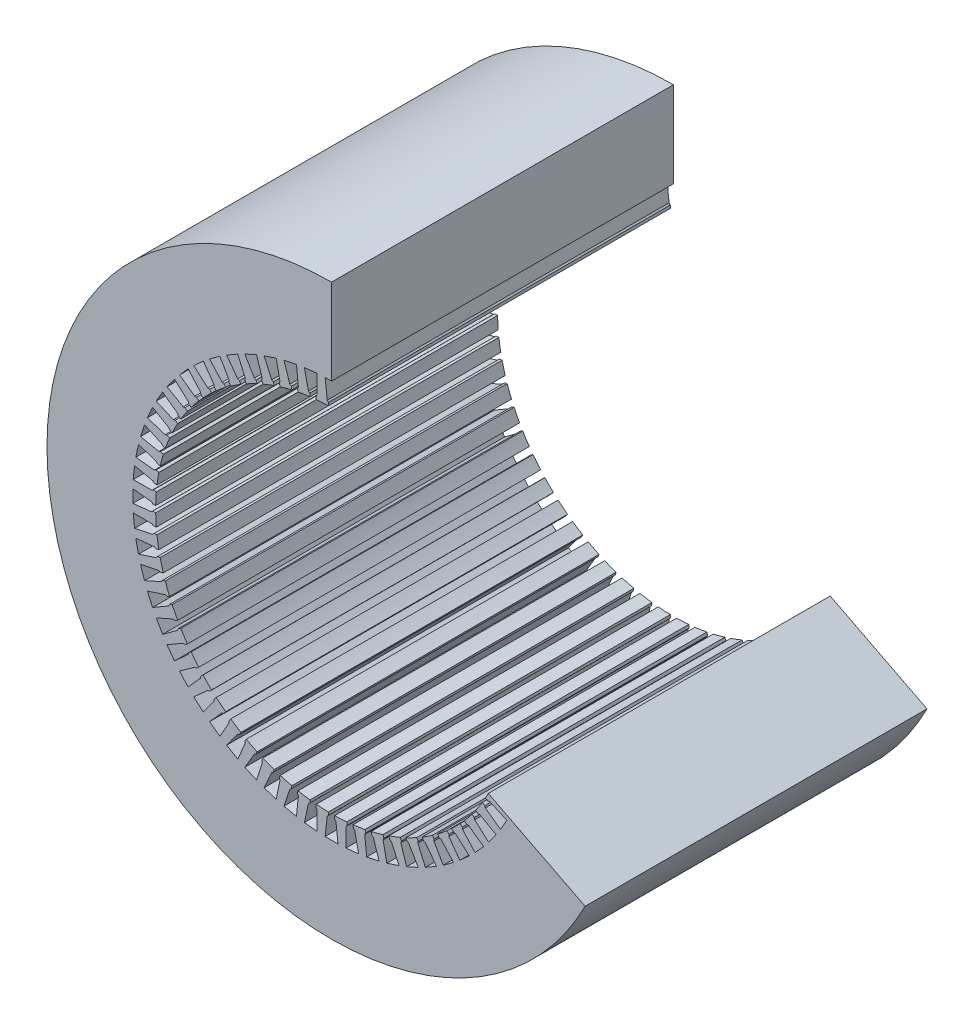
SolidWorks part; units mm, degrees
ref_plane "Přední rovina" through (0, 0, 0) normal (0, 0, 1) x (1, 0, 0)
ref_plane "Horní rovina" through (0, 0, 0) normal (0, 1, 0) x (1, 0, 0)
ref_plane "Pravá rovina" through (0, 0, 0) normal (1, 0, 0) x (0, 0, -1)
sketch "Skica1" plane through (0, 0, 0) normal (0, 0, 1) x (1, 0, 0)
  line L0 (0, 148.7514) -> (0, -162.0328) construction
  line L1 (-203.1858, 0) -> (251.9227, 0) construction
  line L2 (1.4, 79.8) -> (1.4, 78.4875)
  line L3 (0, 78.5) -> (0, 88.71)
  line L4 (-2.855, 88.71) -> (2.855, 88.71)
  line L5 (0, 88.71) -> (0, 80.4)
  line L7 (0, 80.4) -> (0, 79.8)
  line L9 (1.4, 79.8) -> (1.945, 80.4)
  line L10 (2.855, 88.71) -> (1.945, 80.4)
  line L11 (-1.4, 79.8) -> (-1.945, 80.4)
  line L12 (-2.855, 88.71) -> (-1.945, 80.4)
  line L13 (6.4334, 88.5225) -> (6.4697, 80.1629)
  line L14 (6.4334, 88.5225) -> (12.1121, 87.9256)
  line L15 (12.1121, 87.9256) -> (10.3384, 79.7563)
  line L16 (6.949, 79.5092) -> (6.4697, 80.1629)
  line L18 (9.7337, 79.2165) -> (10.3384, 79.7563)
  line L19 (15.6512, 87.3651) -> (14.8136, 79.0475)
  line L20 (15.6512, 87.3651) -> (21.2365, 86.1779)
  line L21 (21.2365, 86.1779) -> (18.6186, 78.2387)
  line L22 (15.2219, 78.3473) -> (14.8136, 79.0475)
  line L24 (17.9608, 77.7651) -> (18.6186, 78.2387)
  line L25 (24.6976, 85.2505) -> (22.9952, 77.066)
  line L26 (24.6976, 85.2505) -> (30.1282, 83.486)
  line L27 (30.1282, 83.486) -> (26.6948, 75.8639)
  line L28 (23.3281, 76.3269) -> (22.9952, 77.066)
  line L30 (25.991, 75.4617) -> (26.6948, 75.8639)
  line L31 (33.4734, 82.2019) -> (30.9248, 74.2402)
  line L32 (33.4734, 82.2019) -> (38.6898, 79.8794)
  line L33 (38.6898, 79.8794) -> (34.4785, 72.658)
  line L34 (31.1786, 73.4704) -> (30.9248, 74.2402)
  line L36 (33.7365, 72.3315) -> (34.4785, 72.658)
  line L37 (41.8825, 78.2526) -> (38.5156, 70.6009)
  line L38 (41.8825, 78.2526) -> (46.8275, 75.3976)
  line L39 (46.8275, 75.3976) -> (41.8844, 68.6559)
  line L40 (38.6876, 69.8088) -> (38.5156, 70.6009)
  line L42 (41.1124, 68.4088) -> (41.8844, 68.6559)
  line L43 (49.8327, 73.446) -> (45.6844, 66.1882)
  line L44 (49.8327, 73.446) -> (54.4522, 70.0898)
  line L45 (54.4522, 70.0898) -> (48.8315, 63.9017)
  line L46 (45.7726, 65.3825) -> (45.6844, 66.1882)
  line L48 (48.0379, 63.7367) -> (48.8315, 63.9017)
  line L49 (57.2369, 67.8347) -> (52.3527, 61.0503)
  line L50 (57.2369, 67.8347) -> (61.4803, 64.014)
  line L51 (61.4803, 64.014) -> (55.2435, 58.4474)
  line L52 (52.3562, 60.2397) -> (52.3527, 61.0503)
  line L54 (54.437, 58.3662) -> (55.2435, 58.4474)
  line L55 (64.014, 61.4803) -> (58.4474, 55.2435)
  line L56 (64.014, 61.4803) -> (67.8347, 57.2369)
  line L57 (67.8347, 57.2369) -> (61.0503, 52.3527)
  line L58 (58.3662, 54.437) -> (58.4474, 55.2435)
  line L60 (60.2397, 52.3562) -> (61.0503, 52.3527)
  line L61 (70.0898, 54.4522) -> (63.9017, 48.8315)
  line L62 (70.0898, 54.4522) -> (73.446, 49.8327)
  line L63 (73.446, 49.8327) -> (66.1882, 45.6844)
  line L64 (63.7367, 48.0379) -> (63.9017, 48.8315)
  line L66 (65.3825, 45.7726) -> (66.1882, 45.6844)
  line L67 (75.3976, 46.8275) -> (68.6559, 41.8844)
  line L68 (75.3976, 46.8275) -> (78.2526, 41.8825)
  line L69 (78.2526, 41.8825) -> (70.6009, 38.5156)
  line L70 (68.4088, 41.1124) -> (68.6559, 41.8844)
  line L72 (69.8088, 38.6876) -> (70.6009, 38.5156)
  line L73 (79.8794, 38.6898) -> (72.658, 34.4785)
  line L74 (79.8794, 38.6898) -> (82.2019, 33.4734)
  line L75 (82.2019, 33.4734) -> (74.2402, 30.9248)
  line L76 (72.3315, 33.7365) -> (72.658, 34.4785)
  line L78 (73.4704, 31.1786) -> (74.2402, 30.9248)
  line L79 (83.486, 30.1282) -> (75.8639, 26.6948)
  line L80 (83.486, 30.1282) -> (85.2505, 24.6976)
  line L81 (85.2505, 24.6976) -> (77.066, 22.9952)
  line L82 (75.4617, 25.991) -> (75.8639, 26.6948)
  line L84 (76.3269, 23.3281) -> (77.066, 22.9952)
  line L85 (86.1779, 21.2365) -> (78.2387, 18.6186)
  line L86 (86.1779, 21.2365) -> (87.3651, 15.6512)
  line L87 (87.3651, 15.6512) -> (79.0475, 14.8136)
  line L88 (77.7651, 17.9608) -> (78.2387, 18.6186)
  line L90 (78.3473, 15.2219) -> (79.0475, 14.8136)
  line L91 (87.9256, 12.1121) -> (79.7563, 10.3384)
  line L92 (87.9256, 12.1121) -> (88.5225, 6.4334)
  line L93 (88.5225, 6.4334) -> (80.1629, 6.4697)
  line L94 (79.2165, 9.7337) -> (79.7563, 10.3384)
  line L96 (79.5092, 6.949) -> (80.1629, 6.4697)
  line L97 (88.71, 2.855) -> (80.4, 1.945)
  line L98 (88.71, 2.855) -> (88.71, -2.855)
  line L99 (88.71, -2.855) -> (80.4, -1.945)
  line L100 (79.8, 1.4) -> (80.4, 1.945)
  line L102 (79.8, -1.4) -> (80.4, -1.945)
  line L103 (88.5225, -6.4334) -> (80.1629, -6.4697)
  line L104 (88.5225, -6.4334) -> (87.9256, -12.1121)
  line L105 (87.9256, -12.1121) -> (79.7563, -10.3384)
  line L106 (79.5092, -6.949) -> (80.1629, -6.4697)
  line L108 (79.2165, -9.7337) -> (79.7563, -10.3384)
  line L109 (87.3651, -15.6512) -> (79.0475, -14.8136)
  line L110 (87.3651, -15.6512) -> (86.1779, -21.2365)
  line L111 (86.1779, -21.2365) -> (78.2387, -18.6186)
  line L112 (78.3473, -15.2219) -> (79.0475, -14.8136)
  line L114 (77.7651, -17.9608) -> (78.2387, -18.6186)
  line L115 (85.2505, -24.6976) -> (77.066, -22.9952)
  line L116 (85.2505, -24.6976) -> (83.486, -30.1282)
  line L117 (83.486, -30.1282) -> (75.8639, -26.6948)
  line L118 (76.3269, -23.3281) -> (77.066, -22.9952)
  line L120 (75.4617, -25.991) -> (75.8639, -26.6948)
  line L121 (82.2019, -33.4734) -> (74.2402, -30.9248)
  line L122 (82.2019, -33.4734) -> (79.8794, -38.6898)
  line L123 (79.8794, -38.6898) -> (72.658, -34.4785)
  line L124 (73.4704, -31.1786) -> (74.2402, -30.9248)
  line L126 (72.3315, -33.7365) -> (72.658, -34.4785)
  line L127 (78.2526, -41.8825) -> (70.6009, -38.5156)
  line L128 (78.2526, -41.8825) -> (75.3976, -46.8275)
  line L129 (75.3976, -46.8275) -> (68.6559, -41.8844)
  line L130 (69.8088, -38.6876) -> (70.6009, -38.5156)
  line L132 (68.4088, -41.1124) -> (68.6559, -41.8844)
  line L133 (73.446, -49.8327) -> (66.1882, -45.6844)
  line L134 (73.446, -49.8327) -> (70.0898, -54.4522)
  line L135 (70.0898, -54.4522) -> (63.9017, -48.8315)
  line L136 (65.3825, -45.7726) -> (66.1882, -45.6844)
  line L138 (63.7367, -48.0379) -> (63.9017, -48.8315)
  line L139 (67.8347, -57.2369) -> (61.0503, -52.3527)
  line L140 (67.8347, -57.2369) -> (64.014, -61.4803)
  line L141 (64.014, -61.4803) -> (58.4474, -55.2435)
  line L142 (60.2397, -52.3562) -> (61.0503, -52.3527)
  line L144 (58.3662, -54.437) -> (58.4474, -55.2435)
  line L145 (61.4803, -64.014) -> (55.2435, -58.4474)
  line L146 (61.4803, -64.014) -> (57.2369, -67.8347)
  line L147 (57.2369, -67.8347) -> (52.3527, -61.0503)
  line L148 (54.437, -58.3662) -> (55.2435, -58.4474)
  line L150 (52.3562, -60.2397) -> (52.3527, -61.0503)
  line L151 (54.4522, -70.0898) -> (48.8315, -63.9017)
  line L152 (54.4522, -70.0898) -> (49.8327, -73.446)
  line L153 (49.8327, -73.446) -> (45.6844, -66.1882)
  line L154 (48.0379, -63.7367) -> (48.8315, -63.9017)
  line L156 (45.7726, -65.3825) -> (45.6844, -66.1882)
  line L157 (46.8275, -75.3976) -> (41.8844, -68.6559)
  line L158 (46.8275, -75.3976) -> (41.8825, -78.2526)
  line L159 (41.8825, -78.2526) -> (38.5156, -70.6009)
  line L160 (41.1124, -68.4088) -> (41.8844, -68.6559)
  line L162 (38.6876, -69.8088) -> (38.5156, -70.6009)
  line L163 (38.6898, -79.8794) -> (34.4785, -72.658)
  line L164 (38.6898, -79.8794) -> (33.4734, -82.2019)
  line L165 (33.4734, -82.2019) -> (30.9248, -74.2402)
  line L166 (33.7365, -72.3315) -> (34.4785, -72.658)
  line L168 (31.1786, -73.4704) -> (30.9248, -74.2402)
  line L169 (30.1282, -83.486) -> (26.6948, -75.8639)
  line L170 (30.1282, -83.486) -> (24.6976, -85.2505)
  line L171 (24.6976, -85.2505) -> (22.9952, -77.066)
  line L172 (25.991, -75.4617) -> (26.6948, -75.8639)
  line L174 (23.3281, -76.3269) -> (22.9952, -77.066)
  line L175 (21.2365, -86.1779) -> (18.6186, -78.2387)
  line L176 (21.2365, -86.1779) -> (15.6512, -87.3651)
  line L177 (15.6512, -87.3651) -> (14.8136, -79.0475)
  line L178 (17.9608, -77.7651) -> (18.6186, -78.2387)
  line L180 (15.2219, -78.3473) -> (14.8136, -79.0475)
  line L181 (12.1121, -87.9256) -> (10.3384, -79.7563)
  line L182 (12.1121, -87.9256) -> (6.4334, -88.5225)
  line L183 (6.4334, -88.5225) -> (6.4697, -80.1629)
  line L184 (9.7337, -79.2165) -> (10.3384, -79.7563)
  line L186 (6.949, -79.5092) -> (6.4697, -80.1629)
  line L187 (2.855, -88.71) -> (1.945, -80.4)
  line L188 (2.855, -88.71) -> (-2.855, -88.71)
  line L189 (-2.855, -88.71) -> (-1.945, -80.4)
  line L190 (1.4, -79.8) -> (1.945, -80.4)
  line L192 (-1.4, -79.8) -> (-1.945, -80.4)
  line L193 (-6.4334, -88.5225) -> (-6.4697, -80.1629)
  line L194 (-6.4334, -88.5225) -> (-12.1121, -87.9256)
  line L195 (-12.1121, -87.9256) -> (-10.3384, -79.7563)
  line L196 (-6.949, -79.5092) -> (-6.4697, -80.1629)
  line L198 (-9.7337, -79.2165) -> (-10.3384, -79.7563)
  line L199 (-15.6512, -87.3651) -> (-14.8136, -79.0475)
  line L200 (-15.6512, -87.3651) -> (-21.2365, -86.1779)
  line L201 (-21.2365, -86.1779) -> (-18.6186, -78.2387)
  line L202 (-15.2219, -78.3473) -> (-14.8136, -79.0475)
  line L204 (-17.9608, -77.7651) -> (-18.6186, -78.2387)
  line L205 (-24.6976, -85.2505) -> (-22.9952, -77.066)
  line L206 (-24.6976, -85.2505) -> (-30.1282, -83.486)
  line L207 (-30.1282, -83.486) -> (-26.6948, -75.8639)
  line L208 (-23.3281, -76.3269) -> (-22.9952, -77.066)
  line L210 (-25.991, -75.4617) -> (-26.6948, -75.8639)
  line L211 (-33.4734, -82.2019) -> (-30.9248, -74.2402)
  line L212 (-33.4734, -82.2019) -> (-38.6898, -79.8794)
  line L213 (-38.6898, -79.8794) -> (-34.4785, -72.658)
  line L214 (-31.1786, -73.4704) -> (-30.9248, -74.2402)
  line L216 (-33.7365, -72.3315) -> (-34.4785, -72.658)
  line L217 (-41.8825, -78.2526) -> (-38.5156, -70.6009)
  line L218 (-41.8825, -78.2526) -> (-46.8275, -75.3976)
  line L219 (-46.8275, -75.3976) -> (-41.8844, -68.6559)
  line L220 (-38.6876, -69.8088) -> (-38.5156, -70.6009)
  line L222 (-41.1124, -68.4088) -> (-41.8844, -68.6559)
  line L223 (-49.8327, -73.446) -> (-45.6844, -66.1882)
  line L224 (-49.8327, -73.446) -> (-54.4522, -70.0898)
  line L225 (-54.4522, -70.0898) -> (-48.8315, -63.9017)
  line L226 (-45.7726, -65.3825) -> (-45.6844, -66.1882)
  line L227 (-45.7726, -65.3825) -> (-48.0379, -63.7367)
  line L228 (-48.0379, -63.7367) -> (-48.8315, -63.9017)
  line L229 (-57.2369, -67.8347) -> (-52.3527, -61.0503)
  line L230 (-57.2369, -67.8347) -> (-61.4803, -64.014)
  line L231 (-61.4803, -64.014) -> (-55.2435, -58.4474)
  line L232 (-52.3562, -60.2397) -> (-52.3527, -61.0503)
  line L234 (-54.437, -58.3662) -> (-55.2435, -58.4474)
  line L235 (-64.014, -61.4803) -> (-58.4474, -55.2435)
  line L236 (-64.014, -61.4803) -> (-67.8347, -57.2369)
  line L237 (-67.8347, -57.2369) -> (-61.0503, -52.3527)
  line L238 (-58.3662, -54.437) -> (-58.4474, -55.2435)
  line L240 (-60.2397, -52.3562) -> (-61.0503, -52.3527)
  line L241 (-70.0898, -54.4522) -> (-63.9017, -48.8315)
  line L242 (-70.0898, -54.4522) -> (-73.446, -49.8327)
  line L243 (-73.446, -49.8327) -> (-66.1882, -45.6844)
  line L244 (-63.7367, -48.0379) -> (-63.9017, -48.8315)
  line L246 (-65.3825, -45.7726) -> (-66.1882, -45.6844)
  line L247 (-75.3976, -46.8275) -> (-68.6559, -41.8844)
  line L248 (-75.3976, -46.8275) -> (-78.2526, -41.8825)
  line L249 (-78.2526, -41.8825) -> (-70.6009, -38.5156)
  line L250 (-68.4088, -41.1124) -> (-68.6559, -41.8844)
  line L252 (-69.8088, -38.6876) -> (-70.6009, -38.5156)
  line L253 (-79.8794, -38.6898) -> (-72.658, -34.4785)
  line L254 (-79.8794, -38.6898) -> (-82.2019, -33.4734)
  line L255 (-82.2019, -33.4734) -> (-74.2402, -30.9248)
  line L256 (-72.3315, -33.7365) -> (-72.658, -34.4785)
  line L258 (-73.4704, -31.1786) -> (-74.2402, -30.9248)
  line L259 (-83.486, -30.1282) -> (-75.8639, -26.6948)
  line L260 (-83.486, -30.1282) -> (-85.2505, -24.6976)
  line L261 (-85.2505, -24.6976) -> (-77.066, -22.9952)
  line L262 (-75.4617, -25.991) -> (-75.8639, -26.6948)
  line L263 (-75.4617, -25.991) -> (-76.3269, -23.3281)
  line L264 (-76.3269, -23.3281) -> (-77.066, -22.9952)
  line L265 (-86.1779, -21.2365) -> (-78.2387, -18.6186)
  line L266 (-86.1779, -21.2365) -> (-87.3651, -15.6512)
  line L267 (-87.3651, -15.6512) -> (-79.0475, -14.8136)
  line L268 (-77.7651, -17.9608) -> (-78.2387, -18.6186)
  line L269 (-77.7651, -17.9608) -> (-78.3473, -15.2219)
  line L270 (-78.3473, -15.2219) -> (-79.0475, -14.8136)
  line L271 (-87.9256, -12.1121) -> (-79.7563, -10.3384)
  line L272 (-87.9256, -12.1121) -> (-88.5225, -6.4334)
  line L273 (-88.5225, -6.4334) -> (-80.1629, -6.4697)
  line L274 (-79.2165, -9.7337) -> (-79.7563, -10.3384)
  line L276 (-79.5092, -6.949) -> (-80.1629, -6.4697)
  line L277 (-88.71, -2.855) -> (-80.4, -1.945)
  line L278 (-88.71, -2.855) -> (-88.71, 2.855)
  line L279 (-88.71, 2.855) -> (-80.4, 1.945)
  line L280 (-79.8, -1.4) -> (-80.4, -1.945)
  line L282 (-79.8, 1.4) -> (-80.4, 1.945)
  line L283 (-88.5225, 6.4334) -> (-80.1629, 6.4697)
  line L284 (-88.5225, 6.4334) -> (-87.9256, 12.1121)
  line L285 (-87.9256, 12.1121) -> (-79.7563, 10.3384)
  line L286 (-79.5092, 6.949) -> (-80.1629, 6.4697)
  line L288 (-79.2165, 9.7337) -> (-79.7563, 10.3384)
  line L289 (-87.3651, 15.6512) -> (-79.0475, 14.8136)
  line L290 (-87.3651, 15.6512) -> (-86.1779, 21.2365)
  line L291 (-86.1779, 21.2365) -> (-78.2387, 18.6186)
  line L292 (-78.3473, 15.2219) -> (-79.0475, 14.8136)
  line L294 (-77.7651, 17.9608) -> (-78.2387, 18.6186)
  line L295 (-85.2505, 24.6976) -> (-77.066, 22.9952)
  line L296 (-85.2505, 24.6976) -> (-83.486, 30.1282)
  line L297 (-83.486, 30.1282) -> (-75.8639, 26.6948)
  line L298 (-76.3269, 23.3281) -> (-77.066, 22.9952)
  line L300 (-75.4617, 25.991) -> (-75.8639, 26.6948)
  line L301 (-82.2019, 33.4734) -> (-74.2402, 30.9248)
  line L302 (-82.2019, 33.4734) -> (-79.8794, 38.6898)
  line L303 (-79.8794, 38.6898) -> (-72.658, 34.4785)
  line L304 (-73.4704, 31.1786) -> (-74.2402, 30.9248)
  line L306 (-72.3315, 33.7365) -> (-72.658, 34.4785)
  line L307 (-78.2526, 41.8825) -> (-70.6009, 38.5156)
  line L308 (-78.2526, 41.8825) -> (-75.3976, 46.8275)
  line L309 (-75.3976, 46.8275) -> (-68.6559, 41.8844)
  line L310 (-69.8088, 38.6876) -> (-70.6009, 38.5156)
  line L312 (-68.4088, 41.1124) -> (-68.6559, 41.8844)
  line L313 (-73.446, 49.8327) -> (-66.1882, 45.6844)
  line L314 (-73.446, 49.8327) -> (-70.0898, 54.4522)
  line L315 (-70.0898, 54.4522) -> (-63.9017, 48.8315)
  line L316 (-65.3825, 45.7726) -> (-66.1882, 45.6844)
  line L318 (-63.7367, 48.0379) -> (-63.9017, 48.8315)
  line L319 (-67.8347, 57.2369) -> (-61.0503, 52.3527)
  line L320 (-67.8347, 57.2369) -> (-64.014, 61.4803)
  line L321 (-64.014, 61.4803) -> (-58.4474, 55.2435)
  line L322 (-60.2397, 52.3562) -> (-61.0503, 52.3527)
  line L324 (-58.3662, 54.437) -> (-58.4474, 55.2435)
  line L325 (-61.4803, 64.014) -> (-55.2435, 58.4474)
  line L326 (-61.4803, 64.014) -> (-57.2369, 67.8347)
  line L327 (-57.2369, 67.8347) -> (-52.3527, 61.0503)
  line L328 (-54.437, 58.3662) -> (-55.2435, 58.4474)
  line L330 (-52.3562, 60.2397) -> (-52.3527, 61.0503)
  line L331 (-54.4522, 70.0898) -> (-48.8315, 63.9017)
  line L332 (-54.4522, 70.0898) -> (-49.8327, 73.446)
  line L333 (-49.8327, 73.446) -> (-45.6844, 66.1882)
  line L334 (-48.0379, 63.7367) -> (-48.8315, 63.9017)
  line L336 (-45.7726, 65.3825) -> (-45.6844, 66.1882)
  line L337 (-46.8275, 75.3976) -> (-41.8844, 68.6559)
  line L338 (-46.8275, 75.3976) -> (-41.8825, 78.2526)
  line L339 (-41.8825, 78.2526) -> (-38.5156, 70.6009)
  line L340 (-41.1124, 68.4088) -> (-41.8844, 68.6559)
  line L342 (-38.6876, 69.8088) -> (-38.5156, 70.6009)
  line L343 (-38.6898, 79.8794) -> (-34.4785, 72.658)
  line L344 (-38.6898, 79.8794) -> (-33.4734, 82.2019)
  line L345 (-33.4734, 82.2019) -> (-30.9248, 74.2402)
  line L346 (-33.7365, 72.3315) -> (-34.4785, 72.658)
  line L348 (-31.1786, 73.4704) -> (-30.9248, 74.2402)
  line L349 (-30.1282, 83.486) -> (-26.6948, 75.8639)
  line L350 (-30.1282, 83.486) -> (-24.6976, 85.2505)
  line L351 (-24.6976, 85.2505) -> (-22.9952, 77.066)
  line L352 (-25.991, 75.4617) -> (-26.6948, 75.8639)
  line L354 (-23.3281, 76.3269) -> (-22.9952, 77.066)
  line L355 (-21.2365, 86.1779) -> (-18.6186, 78.2387)
  line L356 (-21.2365, 86.1779) -> (-15.6512, 87.3651)
  line L357 (-15.6512, 87.3651) -> (-14.8136, 79.0475)
  line L358 (-17.9608, 77.7651) -> (-18.6186, 78.2387)
  line L360 (-15.2219, 78.3473) -> (-14.8136, 79.0475)
  line L361 (-12.1121, 87.9256) -> (-10.3384, 79.7563)
  line L362 (-12.1121, 87.9256) -> (-6.4334, 88.5225)
  line L363 (-6.4334, 88.5225) -> (-6.4697, 80.1629)
  line L364 (-9.7337, 79.2165) -> (-10.3384, 79.7563)
  line L366 (-6.949, 79.5092) -> (-6.4697, 80.1629)
  line L367 (-1.4, 79.8) -> (-1.4, 78.4875)
  line L368 (6.949, 79.5092) -> (6.8118, 78.2039)
  line L369 (9.7337, 79.2165) -> (9.5965, 77.9112)
  line L370 (15.2219, 78.3473) -> (14.9491, 77.0635)
  line L371 (17.9608, 77.7651) -> (17.6879, 76.4813)
  line L372 (23.3281, 76.3269) -> (22.9225, 75.0787)
  line L373 (25.991, 75.4617) -> (25.5855, 74.2134)
  line L374 (31.1786, 73.4704) -> (30.6448, 72.2713)
  line L375 (33.7365, 72.3315) -> (33.2027, 71.1325)
  line L376 (38.6876, 69.8088) -> (38.0313, 68.6722)
  line L377 (41.1124, 68.4088) -> (40.4562, 67.2722)
  line L378 (45.7726, 65.3825) -> (45.0012, 64.3206)
  line L379 (48.0379, 63.7367) -> (47.2664, 62.6748)
  line L380 (52.3562, 60.2397) -> (51.478, 59.2644)
  line L381 (54.437, 58.3662) -> (53.5588, 57.3908)
  line L382 (58.3662, 54.437) -> (57.3908, 53.5588)
  line L383 (60.2397, 52.3562) -> (59.2644, 51.478)
  line L384 (63.7367, 48.0379) -> (62.6748, 47.2664)
  line L385 (65.3825, 45.7726) -> (64.3206, 45.0012)
  line L386 (68.4088, 41.1124) -> (67.2722, 40.4562)
  line L387 (69.8088, 38.6876) -> (68.6722, 38.0313)
  line L388 (72.3315, 33.7365) -> (71.1325, 33.2027)
  line L389 (73.4704, 31.1786) -> (72.2713, 30.6448)
  line L390 (75.4617, 25.991) -> (74.2134, 25.5855)
  line L391 (76.3269, 23.3281) -> (75.0787, 22.9225)
  line L392 (77.7651, 17.9608) -> (76.4813, 17.6879)
  line L393 (78.3473, 15.2219) -> (77.0635, 14.9491)
  line L394 (79.2165, 9.7337) -> (77.9112, 9.5965)
  line L395 (79.5092, 6.949) -> (78.2039, 6.8118)
  line L396 (79.8, 1.4) -> (78.4875, 1.4)
  line L397 (79.8, -1.4) -> (78.4875, -1.4)
  line L398 (79.5092, -6.949) -> (78.2039, -6.8118)
  line L399 (79.2165, -9.7337) -> (77.9112, -9.5965)
  line L400 (78.3473, -15.2219) -> (77.0635, -14.9491)
  line L401 (77.7651, -17.9608) -> (76.4813, -17.6879)
  line L402 (76.3269, -23.3281) -> (75.0787, -22.9225)
  line L403 (75.4617, -25.991) -> (74.2134, -25.5855)
  line L404 (73.4704, -31.1786) -> (72.2713, -30.6448)
  line L405 (72.3315, -33.7365) -> (71.1325, -33.2027)
  line L406 (69.8088, -38.6876) -> (68.6722, -38.0313)
  line L407 (68.4088, -41.1124) -> (67.2722, -40.4562)
  line L408 (65.3825, -45.7726) -> (64.3206, -45.0012)
  line L409 (63.7367, -48.0379) -> (62.6748, -47.2664)
  line L410 (60.2397, -52.3562) -> (59.2644, -51.478)
  line L411 (58.3662, -54.437) -> (57.3908, -53.5588)
  line L412 (54.437, -58.3662) -> (53.5588, -57.3908)
  line L413 (52.3562, -60.2397) -> (51.478, -59.2644)
  line L414 (48.0379, -63.7367) -> (47.2664, -62.6748)
  line L415 (45.7726, -65.3825) -> (45.0012, -64.3206)
  line L416 (41.1124, -68.4088) -> (40.4562, -67.2722)
  line L417 (38.6876, -69.8088) -> (38.0313, -68.6722)
  line L418 (33.7365, -72.3315) -> (33.2027, -71.1325)
  line L419 (31.1786, -73.4704) -> (30.6448, -72.2713)
  line L420 (25.991, -75.4617) -> (25.5855, -74.2134)
  line L421 (23.3281, -76.3269) -> (22.9225, -75.0787)
  line L422 (17.9608, -77.7651) -> (17.6879, -76.4813)
  line L423 (15.2219, -78.3473) -> (14.9491, -77.0635)
  line L424 (9.7337, -79.2165) -> (9.5965, -77.9112)
  line L425 (6.949, -79.5092) -> (6.8118, -78.2039)
  line L426 (1.4, -79.8) -> (1.4, -78.4875)
  line L427 (-1.4, -79.8) -> (-1.4, -78.4875)
  line L428 (-6.949, -79.5092) -> (-6.8118, -78.2039)
  line L429 (-9.7337, -79.2165) -> (-9.5965, -77.9112)
  line L430 (-15.2219, -78.3473) -> (-14.9491, -77.0635)
  line L431 (-17.9608, -77.7651) -> (-17.6879, -76.4813)
  line L432 (-23.3281, -76.3269) -> (-22.9225, -75.0787)
  line L433 (-25.991, -75.4617) -> (-25.5855, -74.2134)
  line L434 (-31.1786, -73.4704) -> (-30.6448, -72.2713)
  line L435 (-33.7365, -72.3315) -> (-33.2027, -71.1325)
  line L436 (-38.6876, -69.8088) -> (-38.0313, -68.6722)
  line L437 (-41.1124, -68.4088) -> (-40.4562, -67.2722)
  line L438 (-45.7726, -65.3825) -> (-45.0012, -64.3206)
  line L439 (-48.0379, -63.7367) -> (-47.2664, -62.6748)
  line L440 (-52.3562, -60.2397) -> (-51.478, -59.2644)
  line L441 (-54.437, -58.3662) -> (-53.5588, -57.3908)
  line L442 (-58.3662, -54.437) -> (-57.3908, -53.5588)
  line L443 (-60.2397, -52.3562) -> (-59.2644, -51.478)
  line L444 (-63.7367, -48.0379) -> (-62.6748, -47.2664)
  line L445 (-65.3825, -45.7726) -> (-64.3206, -45.0012)
  line L446 (-68.4088, -41.1124) -> (-67.2722, -40.4562)
  line L447 (-69.8088, -38.6876) -> (-68.6722, -38.0313)
  line L448 (-72.3315, -33.7365) -> (-71.1325, -33.2027)
  line L449 (-73.4704, -31.1786) -> (-72.2713, -30.6448)
  line L450 (-75.4617, -25.991) -> (-74.2134, -25.5855)
  line L451 (-76.3269, -23.3281) -> (-75.0787, -22.9225)
  line L452 (-77.7651, -17.9608) -> (-76.4813, -17.6879)
  line L453 (-78.3473, -15.2219) -> (-77.0635, -14.9491)
  line L454 (-79.2165, -9.7337) -> (-77.9112, -9.5965)
  line L455 (-79.5092, -6.949) -> (-78.2039, -6.8118)
  line L456 (-79.8, -1.4) -> (-78.4875, -1.4)
  line L457 (-79.8, 1.4) -> (-78.4875, 1.4)
  line L458 (-79.5092, 6.949) -> (-78.2039, 6.8118)
  line L459 (-79.2165, 9.7337) -> (-77.9112, 9.5965)
  line L460 (-78.3473, 15.2219) -> (-77.0635, 14.9491)
  line L461 (-77.7651, 17.9608) -> (-76.4813, 17.6879)
  line L462 (-76.3269, 23.3281) -> (-75.0787, 22.9225)
  line L463 (-75.4617, 25.991) -> (-74.2134, 25.5855)
  line L464 (-73.4704, 31.1786) -> (-72.2713, 30.6448)
  line L465 (-72.3315, 33.7365) -> (-71.1325, 33.2027)
  line L466 (-69.8088, 38.6876) -> (-68.6722, 38.0313)
  line L467 (-68.4088, 41.1124) -> (-67.2722, 40.4562)
  line L468 (-65.3825, 45.7726) -> (-64.3206, 45.0012)
  line L469 (-63.7367, 48.0379) -> (-62.6748, 47.2664)
  line L470 (-60.2397, 52.3562) -> (-59.2644, 51.478)
  line L471 (-58.3662, 54.437) -> (-57.3908, 53.5588)
  line L472 (-54.437, 58.3662) -> (-53.5588, 57.3908)
  line L473 (-52.3562, 60.2397) -> (-51.478, 59.2644)
  line L474 (-48.0379, 63.7367) -> (-47.2664, 62.6748)
  line L475 (-45.7726, 65.3825) -> (-45.0012, 64.3206)
  line L476 (-41.1124, 68.4088) -> (-40.4562, 67.2722)
  line L477 (-38.6876, 69.8088) -> (-38.0313, 68.6722)
  line L478 (-33.7365, 72.3315) -> (-33.2027, 71.1325)
  line L479 (-31.1786, 73.4704) -> (-30.6448, 72.2713)
  line L480 (-25.991, 75.4617) -> (-25.5855, 74.2134)
  line L481 (-23.3281, 76.3269) -> (-22.9225, 75.0787)
  line L482 (-17.9608, 77.7651) -> (-17.6879, 76.4813)
  line L483 (-15.2219, 78.3473) -> (-14.9491, 77.0635)
  line L484 (-9.7337, 79.2165) -> (-9.5965, 77.9112)
  line L485 (-6.949, 79.5092) -> (-6.8118, 78.2039)
  arc A0 (-1.4, 78.4875) -> (-6.8118, 78.2039) centre (0, 0) ccw
  circle A1 centre (0, 0) radius 127
  arc A2 (-9.5965, 77.9112) -> (-14.9491, 77.0635) centre (0, 0) ccw
  arc A3 (-17.6879, 76.4813) -> (-22.9225, 75.0787) centre (0, 0) ccw
  arc A4 (-25.5855, 74.2134) -> (-30.6448, 72.2713) centre (0, 0) ccw
  arc A5 (6.8118, 78.2039) -> (1.4, 78.4875) centre (0, 0) ccw
  arc A6 (14.9491, 77.0635) -> (9.5965, 77.9112) centre (0, 0) ccw
  arc A7 (-33.2027, 71.1325) -> (-38.0313, 68.6722) centre (0, 0) ccw
  arc A8 (-40.4562, 67.2722) -> (-45.0012, 64.3206) centre (0, 0) ccw
  arc A9 (-47.2664, 62.6748) -> (-51.478, 59.2644) centre (0, 0) ccw
  arc A10 (-53.5588, 57.3908) -> (-57.3908, 53.5588) centre (0, 0) ccw
  arc A11 (-59.2644, 51.478) -> (-62.6748, 47.2664) centre (0, 0) ccw
  arc A12 (-64.3206, 45.0012) -> (-67.2722, 40.4562) centre (0, 0) ccw
  arc A13 (-68.6722, 38.0313) -> (-71.1325, 33.2027) centre (0, 0) ccw
  arc A14 (-72.2713, 30.6448) -> (-74.2134, 25.5855) centre (0, 0) ccw
  arc A15 (-75.0787, 22.9225) -> (-76.4813, 17.6879) centre (0, 0) ccw
  arc A16 (-77.0635, 14.9491) -> (-77.9112, 9.5965) centre (0, 0) ccw
  arc A17 (-78.2039, 6.8118) -> (-78.4875, 1.4) centre (0, 0) ccw
  arc A18 (-78.4875, -1.4) -> (-78.2039, -6.8118) centre (0, 0) ccw
  arc A19 (-77.9112, -9.5965) -> (-77.0635, -14.9491) centre (0, 0) ccw
  arc A20 (-76.4813, -17.6879) -> (-75.0787, -22.9225) centre (0, 0) ccw
  arc A21 (-74.2134, -25.5855) -> (-72.2713, -30.6448) centre (0, 0) ccw
  arc A22 (-71.1325, -33.2027) -> (-68.6722, -38.0313) centre (0, 0) ccw
  arc A23 (-67.2722, -40.4562) -> (-64.3206, -45.0012) centre (0, 0) ccw
  arc A24 (-62.6748, -47.2664) -> (-59.2644, -51.478) centre (0, 0) ccw
  arc A25 (-57.3908, -53.5588) -> (-53.5588, -57.3908) centre (0, 0) ccw
  arc A26 (-51.478, -59.2644) -> (-47.2664, -62.6748) centre (0, 0) ccw
  arc A27 (-45.0012, -64.3206) -> (-40.4562, -67.2722) centre (0, 0) ccw
  arc A28 (-38.0313, -68.6722) -> (-33.2027, -71.1325) centre (0, 0) ccw
  arc A29 (-30.6448, -72.2713) -> (-25.5855, -74.2134) centre (0, 0) ccw
  arc A30 (-22.9225, -75.0787) -> (-17.6879, -76.4813) centre (0, 0) ccw
  arc A31 (-14.9491, -77.0635) -> (-9.5965, -77.9112) centre (0, 0) ccw
  arc A32 (-6.8118, -78.2039) -> (-1.4, -78.4875) centre (0, 0) ccw
  arc A33 (1.4, -78.4875) -> (6.8118, -78.2039) centre (0, 0) ccw
  arc A34 (9.5965, -77.9112) -> (14.9491, -77.0635) centre (0, 0) ccw
  arc A35 (17.6879, -76.4813) -> (22.9225, -75.0787) centre (0, 0) ccw
  arc A36 (25.5855, -74.2134) -> (30.6448, -72.2713) centre (0, 0) ccw
  arc A37 (33.2027, -71.1325) -> (38.0313, -68.6722) centre (0, 0) ccw
  arc A38 (40.4562, -67.2722) -> (45.0012, -64.3206) centre (0, 0) ccw
  arc A39 (47.2664, -62.6748) -> (51.478, -59.2644) centre (0, 0) ccw
  arc A40 (53.5588, -57.3908) -> (57.3908, -53.5588) centre (0, 0) ccw
  arc A41 (59.2644, -51.478) -> (62.6748, -47.2664) centre (0, 0) ccw
  arc A42 (64.3206, -45.0012) -> (67.2722, -40.4562) centre (0, 0) ccw
  arc A43 (68.6722, -38.0313) -> (71.1325, -33.2027) centre (0, 0) ccw
  arc A44 (72.2713, -30.6448) -> (74.2134, -25.5855) centre (0, 0) ccw
  arc A45 (75.0787, -22.9225) -> (76.4813, -17.6879) centre (0, 0) ccw
  arc A46 (77.0635, -14.9491) -> (77.9112, -9.5965) centre (0, 0) ccw
  arc A47 (78.2039, -6.8118) -> (78.4875, -1.4) centre (0, 0) ccw
  arc A48 (78.4875, 1.4) -> (78.2039, 6.8118) centre (0, 0) ccw
  arc A49 (77.9112, 9.5965) -> (77.0635, 14.9491) centre (0, 0) ccw
  arc A50 (76.4813, 17.6879) -> (75.0787, 22.9225) centre (0, 0) ccw
  arc A51 (74.2134, 25.5855) -> (72.2713, 30.6448) centre (0, 0) ccw
  arc A52 (71.1325, 33.2027) -> (68.6722, 38.0313) centre (0, 0) ccw
  arc A53 (67.2722, 40.4562) -> (64.3206, 45.0012) centre (0, 0) ccw
  arc A54 (62.6748, 47.2664) -> (59.2644, 51.478) centre (0, 0) ccw
  arc A55 (22.9225, 75.0787) -> (17.6879, 76.4813) centre (0, 0) ccw
  arc A56 (30.6448, 72.2713) -> (25.5855, 74.2134) centre (0, 0) ccw
  arc A57 (38.0313, 68.6722) -> (33.2027, 71.1325) centre (0, 0) ccw
  arc A58 (45.0012, 64.3206) -> (40.4562, 67.2722) centre (0, 0) ccw
  arc A59 (51.478, 59.2644) -> (47.2664, 62.6748) centre (0, 0) ccw
  arc A60 (57.3908, 53.5588) -> (53.5588, 57.3908) centre (0, 0) ccw
  point P375 (0, 0)
  point P612 (0, 0)
  dimension "D1" = 254
  dimension "D2" = 157
  dimension "D11" = 78.5
  dimension "D3" = 1.3125
  dimension "D4" = 10.21
  dimension "D5" = 2.855
  dimension "D6" = 8.31
  dimension "D7" = 1.945
  dimension "D8" = 0.6
  dimension "D9" = 60
  dimension "D12" = 88.71
  dimension "D10" = 60
extrude "Přidat vysunutím1" add sketch "Skica1" along normal blind 152.6 contours A1 A60 L382 L58 L55 L56 L57 L60 L383 A54 L384 L64 L61 L62 L63 L66 L385 A53 L386 L70 L67 L68 L69 L72 L387 A52 L388 L76 L73 L74 L75 L78 L389 A51 L390 L82 L79 L80 L81 L84 L391 A50 L392 L88 L85 L86 L87 L90 L393 A49
scale "Měřítko1" scale about origin uniform scaling yes scale factor 0.655
sketch "Skica4" plane through (0, 0, 99.953) normal (0, 0, 1) x (1, 0, 0)
  line L0 (0, 83.185) -> (0, 0)
  line L1 (0, 0) -> (74.1184, -37.7652)
  circle A1 centre (0, 0) radius 83.185
  circle A2 centre (0, 0) radius 83.185
  dimension "D2" = 117
  dimension "D1" = 0
extrude "Odebrat vysunutím1" cut sketch "Skica4" against normal through all contours L1 A2 L0
